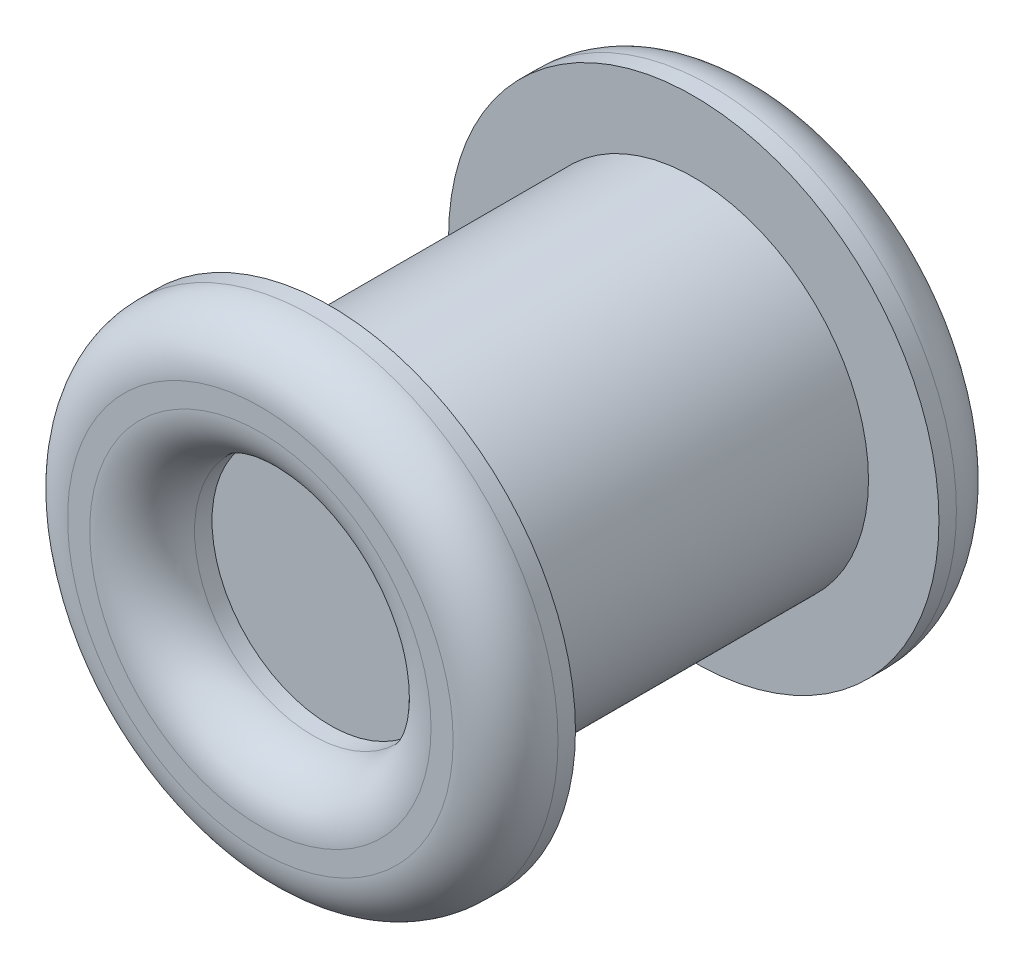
SolidWorks part; units mm, degrees
ref_plane "Front" through (0, 0, 0) normal (0, 0, 1) x (1, 0, 0)
ref_plane "Top" through (0, 0, 0) normal (0, 1, 0) x (1, 0, 0)
ref_plane "Right" through (0, 0, 0) normal (1, 0, 0) x (0, 0, -1)
sketch "Esquisse1" plane through (0, 0, 0) normal (0, 0, 1) x (1, 0, 0)
  circle A0 centre (0, -54) radius 2.5 construction
  circle A1 centre (0, -54) radius 2.5
extrude "Boss.-Extru.1" add sketch "Esquisse1" against normal up to vertex (2.6 mm away) and the other way up to vertex (2.6 mm away)
sketch "Esquisse2" plane through (0, 0, 2.6) normal (0, 0, 1) x (1, 0, 0)
  circle A0 centre (0, -54) radius 3.5079
  circle A1 centre (0, -54) radius 1.6918
extrude "Boss.-Extru.2" add sketch "Esquisse2" along normal blind 1
mirror "Symétrie1" about plane through (0, 0, 0) normal (0, 0, 1) of "Boss.-Extru.2"
fillet "Congé1" radius 0.75 4 edges at (1.6918, -54, -3.6) (1.6918, -54, 3.6) (3.5079, -54, -3.6) (3.5079, -54, 3.6)
